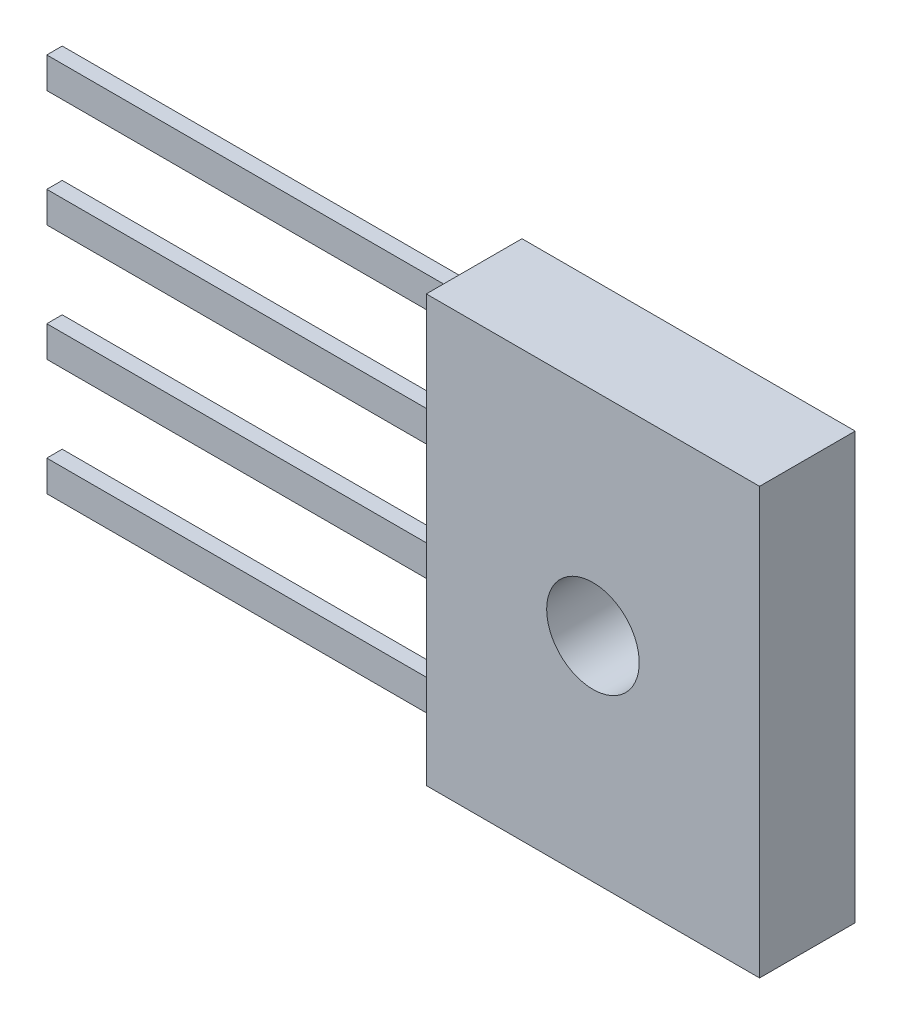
SolidWorks part; units mm, degrees
ref_plane "Plan de face" through (0, 0, 0) normal (0, 0, 1) x (1, 0, 0)
ref_plane "Plan de dessus" through (0, 0, 0) normal (0, 1, 0) x (1, 0, 0)
ref_plane "Plan de droite" through (0, 0, 0) normal (1, 0, 0) x (0, 0, -1)
sketch "Esquisse1" plane through (0, 0, 0) normal (0, 0, 1) x (1, 0, 0)
  line L1 (-5.4, 6.9) -> (5.4, 6.9)
  line L2 (-5.4, 6.9) -> (-5.4, -6.9)
  line L3 (-5.4, -6.9) -> (5.4, -6.9)
  line L4 (5.4, 6.9) -> (5.4, -6.9)
  line L5 (-5.4, 6.9) -> (5.4, -6.9) construction
  line L6 (-5.4, -6.9) -> (5.4, 6.9) construction
  circle A0 centre (0, 0) radius 1.5
  point P0 (0, 0)
  dimension "D3" = 3
  dimension "D1" = 10.8
  dimension "D2" = 13.8
extrude "Boss.-Extru.1" add sketch "Esquisse1" along normal mid plane 3.1
sketch "Esquisse2" plane through (-5.4, 0, 0) normal (-1, 0, 0) x (0, 0, 1)
  line L0 (1.55, 6.9) -> (-1.55, 6.9) construction
  line L1 (-0.25, 6.1578) -> (0.25, 6.1578)
  line L2 (-0.25, 6.1578) -> (-0.25, 5.1578)
  line L3 (-0.25, 5.1578) -> (0.25, 5.1578)
  line L4 (0.25, 6.1578) -> (0.25, 5.1578)
  line L5 (-0.25, 6.1578) -> (0.25, 5.1578) construction
  line L6 (-0.25, 5.1578) -> (0.25, 6.1578) construction
  line L7 (-0.25, 2.3859) -> (0.25, 2.3859)
  line L8 (-0.25, 2.3859) -> (-0.25, 1.3859)
  line L9 (0.25, 2.3859) -> (0.25, 1.3859)
  line L10 (-0.25, 1.3859) -> (0.25, 1.3859)
  line L11 (-0.25, -1.3859) -> (0.25, -1.3859)
  line L12 (-0.25, -1.3859) -> (-0.25, -2.3859)
  line L13 (0.25, -1.3859) -> (0.25, -2.3859)
  line L14 (-0.25, -2.3859) -> (0.25, -2.3859)
  line L15 (-0.25, -5.1578) -> (0.25, -5.1578)
  line L16 (-0.25, -5.1578) -> (-0.25, -6.1578)
  line L17 (0.25, -5.1578) -> (0.25, -6.1578)
  line L18 (-0.25, -6.1578) -> (0.25, -6.1578)
  line L20 (1.55, -6.9) -> (-1.55, -6.9) construction
  point P0 (0, 5.6578)
extrude "Boss.-Extru.2" add sketch "Esquisse2" along normal blind 13.6
sketch "Esquisse4" plane through (0, 0, -1.55) normal (0, 0, -1) x (-1, 0, 0)
  line L0 (5.4, -6.9) -> (-5.4, -6.9) construction
  circle A0 centre (0, -6.9) radius 1.6
  dimension "D1" = 3.2
extrude "Enlèv. mat.-Extru.2" cut sketch "Esquisse4" against normal blind 0.5
equation "\"D5@Esquisse2\"=\"D3@Esquisse2\""
